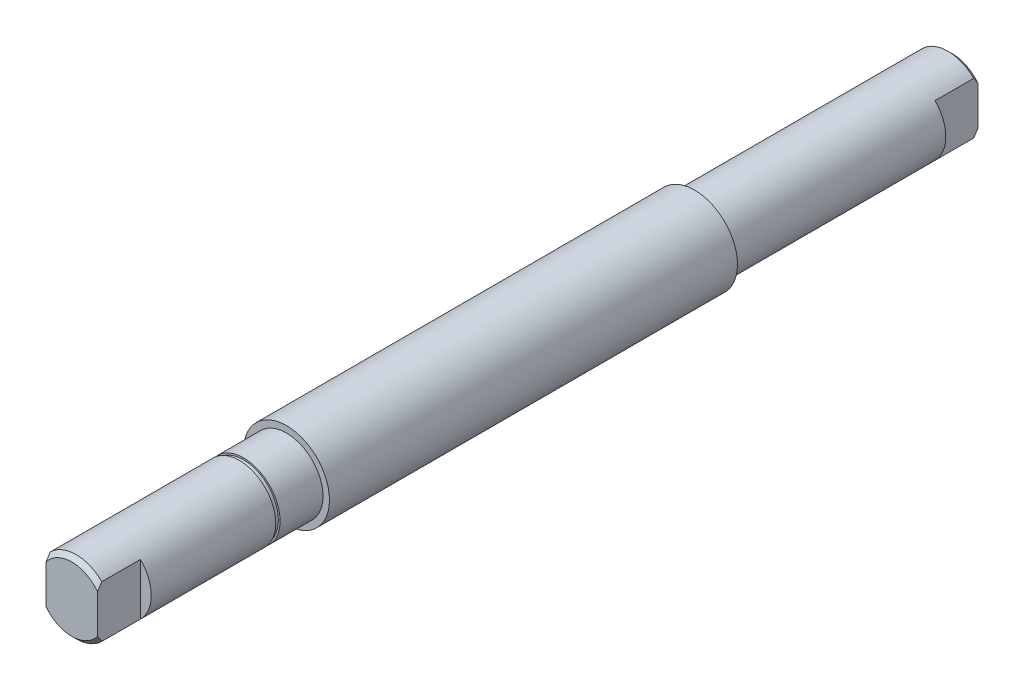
SolidWorks part; units mm, degrees
ref_plane "Plan1" through (0, 0, 0) normal (0, 0, 1) x (1, 0, 0)
ref_plane "Plan2" through (0, 0, 0) normal (0, 1, 0) x (1, 0, 0)
ref_plane "Plan3" through (0, 0, 0) normal (1, 0, 0) x (0, 0, -1)
sketch "Esquisse1" plane through (0, 0, 0) normal (0, 0, 1) x (1, 0, 0)
  circle A0 centre (0, 0) radius 8.5
  dimension "D1" = 17
extrude "Base-Extrusion" add sketch "Esquisse1" along normal blind 60
sketch "Esquisse2" plane through (0, 0, 60) normal (0, 0, 1) x (1, 0, 0)
  circle A0 centre (0, 0) radius 10
  dimension "D1" = 20
extrude "Boss.-Extru.1" add sketch "Esquisse2" along normal blind 95
sketch "Esquisse3" plane through (0, 0, 155) normal (0, 0, 1) x (1, 0, 0)
  circle A0 centre (0, 0) radius 8.5 construction
  circle A1 centre (0, 0) radius 8.5
extrude "Boss.-Extru.2" add sketch "Esquisse3" along normal blind 50
ref_plane "Plan4" through (0, 0, 165) normal (0, 0, 1) x (1, 0, 0)
sketch "Esquisse4" plane through (0, 0, 165) normal (0, 0, 1) x (1, 0, 0)
  circle A0 centre (0, 0) radius 8.1
  circle A2 centre (0, 0) radius 8.5 construction
  circle A3 centre (0, 0) radius 8.5
  dimension "D1" = 16.2
extrude "Enlèv. mat.-Extru.2" cut sketch "Esquisse4" along normal blind 1
sketch "Esquisse5" plane through (0, 0, 205) normal (0, 0, 1) x (1, 0, 0)
  line L0 (6, 6.0208) -> (6, -6.0208)
  line L1 (-6, 6.0208) -> (-6, -6.0208)
  line L2 (0, 0) -> (0, -10) construction
  arc A0 (-6, 6.0208) -> (-6, -6.0208) centre (0, 0) ccw
  circle A1 centre (0, 0) radius 8.5
  arc A2 (6, -6.0208) -> (6, 6.0208) centre (0, 0) ccw
  dimension "D2" = 12
  dimension "D1" = 0
extrude "Enlèv. mat.-Extru.3" cut sketch "Esquisse5" against normal blind 10
sketch "Esquisse6" plane through (0, 0, 0) normal (0, 0, -1) x (-1, 0, 0)
  line L0 (6, -6.0208) -> (6, 6.0208) construction
  line L1 (6, -6.0208) -> (6, 6.0208)
  line L2 (-6, 6.0208) -> (-6, -6.0208) construction
  line L3 (-6, 6.0208) -> (-6, -6.0208)
  arc A0 (-6, 6.0208) -> (-6, -6.0208) centre (0, 0) ccw
  circle A1 centre (0, 0) radius 8.5
  arc A2 (6, -6.0208) -> (6, 6.0208) centre (0, 0) ccw
  dimension "D1" = 0
extrude "Enlèv. mat.-Extru.4" cut sketch "Esquisse6" against normal blind 10
chamfer "Chanfrein1" distance 1 angle 45
